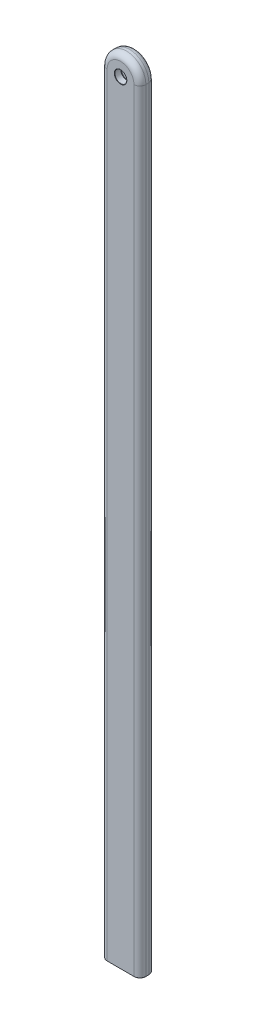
SolidWorks part; units mm, degrees
ref_plane "Спереди" through (0, 0, 0) normal (0, 0, 1) x (1, 0, 0)
ref_plane "Сверху" through (0, 0, 0) normal (0, 1, 0) x (1, 0, 0)
ref_plane "Справа" through (0, 0, 0) normal (1, 0, 0) x (0, 0, -1)
sketch "Эскиз1" plane through (0, 0, 0) normal (0, 0, 1) x (1, 0, 0)
  line L0 (-32.5, 0) -> (-32.5, -1297.5)
  line L1 (-32.5, -1297.5) -> (32.5, -1297.5)
  line L2 (32.5, -1297.5) -> (32.5, 0)
  arc A0 (32.5, 0) -> (-32.5, 0) centre (0, 0) ccw
  dimension "D1" = 65
  dimension "D2" = 1297.5
extrude "Бобышка-Вытянуть1" add sketch "Эскиз1" along normal mid plane 25
fillet "Скругление1" radius 10 6 edges at (-32.5, -648.75, -12.5) (32.5, -648.75, -12.5) (0, 32.5, -12.5) (32.5, -648.75, 12.5) (-32.5, -648.75, 12.5) (0, 32.5, 12.5)
sketch "Эскиз2" plane through (0, 0, 12.5) normal (0, 0, 1) x (1, 0, 0)
  circle A0 centre (0, 0) radius 10
  dimension "D1" = 20
extrude "Вырез-Вытянуть1" cut sketch "Эскиз2" against normal blind 11
sketch "Эскиз3" plane through (0, -1297.5, 0) normal (0, -1, 0) x (1, 0, 0)
  line L0 (-19, 0) -> (0, 0) construction
  line L1 (0, 0) -> (19, 0) construction
  circle A0 centre (0, 0) radius 5
  circle A1 centre (19, 0) radius 5
  circle A2 centre (-19, 0) radius 5
  dimension "D1" = 10
  dimension "D2" = 19
extrude "Вырез-Вытянуть2" cut sketch "Эскиз3" against normal blind 35
sketch "Эскиз4" plane through (-32.5, 0, 0) normal (-1, 0, 0) x (0, 0, 1)
  line L0 (2.5, 32.5) -> (-2.5, 32.5) construction
  circle A0 centre (0, -28.5) radius 5
  circle A1 centre (0, -48.5) radius 5
  dimension "D2" = 10
  dimension "D1" = 20
  dimension "D3" = 61
extrude "Вырез-Вытянуть3" cut sketch "Эскиз4" against normal blind 30
chamfer "Фаска1" distance 0.5 angle 45 26 edges at (10, 0, 12.5) (10, 0, 1.5) (19, -1297.5, -5) (19, -1262.5, -5) (0, -1297.5, -5) (0, -1262.5, -5) (-19, -1297.5, -5) (-19, -1262.5, -5) (-2.5, -53.5, 0) (-32.5, -53.5, 0) (-32.5, -43.5, 0) (-32.1837, -48.7224, 4.9951) (-32.1826, -48.4344, -4.9996) (-2.5, -33.5, 0) (-32.5, -33.5, 0) (-32.5, -23.5, 0) (-32.1837, -28.7224, 4.9951) (-32.1837, -28.2776, -4.9951) (0, -1297.5, -12.5) (-29.5711, -1297.5, -9.5711) (29.5711, -1297.5, -9.5711) (-32.5, -1297.5, 0) (32.5, -1297.5, 0) (-29.5711, -1297.5, 9.5711) (29.5711, -1297.5, 9.5711) (0, -1297.5, 12.5)
